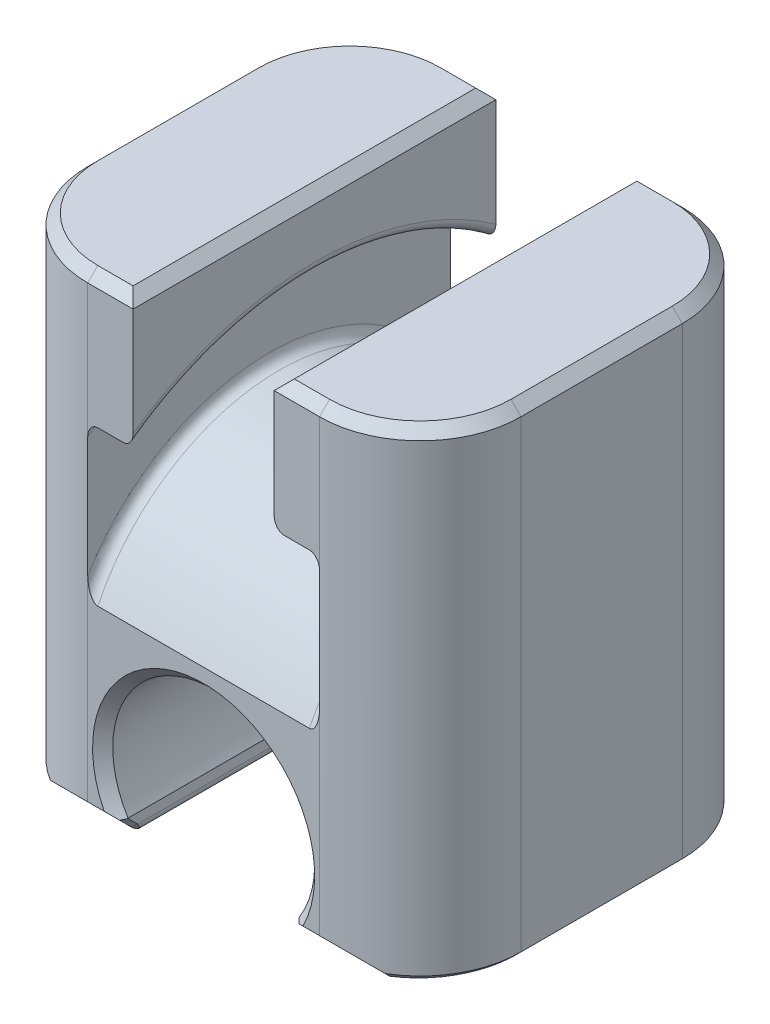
SolidWorks part; units mm, degrees
ref_plane "Front Plane" through (0, 0, 0) normal (0, 0, 1) x (1, 0, 0)
ref_plane "Top Plane" through (0, 0, 0) normal (0, 1, 0) x (1, 0, 0)
ref_plane "Right Plane" through (0, 0, 0) normal (1, 0, 0) x (0, 0, -1)
sketch "Sketch1" plane through (0, 0, 0) normal (1, 0, 0) x (0, 0, -1)
  line L0 (0, 0) -> (0, -5.5) construction
  line L1 (-9, -5.5) -> (9, -5.5)
  line L2 (-9, -5.5) -> (-9, 18.5)
  line L3 (-9, 18.5) -> (9, 18.5)
  line L4 (9, -5.5) -> (9, 18.5)
  dimension "D1" = 18
  dimension "D2" = 5.5
  dimension "D3" = 18.5
  dimension "D5" = 24
extrude "Extrude1" add sketch "Sketch1" along normal mid plane 21.5
sketch "Sketch2" plane through (0, 0, 0) normal (0, 0, 1) x (1, 0, 0)
  line L0 (0, -19.2503) -> (0, 19.2503) construction
  line L10 (0, 0) -> (-20.3314, 0) construction
  line L11 (3.5, 22.132) -> (3.5, 15.02)
  line L12 (3.5, 15.02) -> (5.75, 15.02)
  line L13 (5.75, 15.02) -> (5.75, 10)
  line L14 (5.75, 10) -> (-5.75, 10)
  line L15 (-5.75, 10) -> (-5.75, 15.02)
  line L16 (-5.75, 15.02) -> (-3.5, 15.02)
  line L17 (-3.5, 15.02) -> (-3.5, 22.132)
  line L18 (-3.5, 22.132) -> (3.5, 22.132)
  point P23 (4.625, 15.02)
  dimension "D5" = 7
  dimension "D8" = 11.5
  dimension "D9" = 10
  dimension "D10" = 15.02
  dimension "D11" = 7.112
revolve "Cut-Revolve1" cut sketch "Sketch2" angle 180 mid plane about L10
fillet "Fillet1" radius 5 4 edges at (10.75, 6.5, -9) (10.75, 6.5, 9) (-10.75, 6.5, 9) (-10.75, 6.5, -9)
fillet "Fillet3" radius 0.5 4 edges at (5.75, 10, 0) (5.75, 15.02, 0) (-5.75, 10, 0) (-5.75, 15.02, 0)
fillet "Fillet4" radius 0.5 2 edges at (-3.5, 15.02, 0) (3.5, 15.02, 0)
sketch "Sketch5" plane through (0, 0, 0) normal (0, 0, -1) x (-1, 0, 0)
  line L0 (4.25, -5.5) -> (-4.25, -5.5)
  line L1 (-5.75, -5.5) -> (5.75, -5.5) construction
  line L2 (-4.25, -5.5) -> (-4.25, -4.5004)
  line L4 (4.25, -4.5004) -> (4.25, -5.5)
  line L5 (0, -6.4116) -> (0, -1.8476) construction
  line L6 (0, 3.1624) -> (7.6462, 3.1624) construction
  line L7 (-5.75, -5.5) -> (5.75, -5.5) construction
  arc A0 (4.25, -4.5004) -> (-4.25, -4.5004) centre (0, -1.8476) ccw
  dimension "D1" = 10.02
  dimension "D2" = 1.8476
  dimension "D3" = 8.5
  dimension "D4" = 0.9144
  dimension "D5" = 3.6524
  dimension "D6" = 0.76
extrude "Cut-Extrude3" cut sketch "Sketch5" against normal through all both and the other way through all
sketch "Sketch7" plane through (0, 0, 0) normal (-1, 0, 0) x (0, 0, -1)
  line L0 (7.8, 5.5) -> (9, 4.3)
  line L1 (-4, 5.5) -> (-9, 5.5) construction
  line L2 (0, 0) -> (0, 6.4577) construction
  line L3 (0, 0) -> (6.8869, 0) construction
  line L4 (7.8, 5.5) -> (9, 5.5)
  line L5 (9, 5.5) -> (9, 4.3)
  line L6 (9, 5.5) -> (9, -5.4083) construction
  dimension "D1" = 45
  dimension "D2" = 1.2
extrude "Cut - remove" cut sketch "Sketch7" against normal through all both and the other way through all
mirror "Mirror2" about plane through (0, 0, 0) normal (0, 0, 1) of "Cut - remove"
fillet "Fillet5" radius 0.5 2 edges at (-4.25, -5.5, 0) (4.25, -5.5, 0)
chamfer "Chamfer2" distance 0.5 angle 45 2 edges at (0, 3.1624, -9) (0, 3.1624, 9)
chamfer "Chamfer3" distance 0.2 angle 45 12 edges at (4.25, -4.8473, -8.4527) (4.25, -4.8473, 8.4527) (-4.25, -4.8473, -8.4527) (-4.25, -4.8473, 8.4527) (6.8748, -5.5, -7.8) (4.3964, -5.3536, -7.9464) (6.8748, -5.5, 7.8) (4.3964, -5.3536, 7.9464) (-6.8748, -5.5, -7.8) (-4.3964, -5.3536, -7.9464) (-6.8748, -5.5, 7.8) (-4.3964, -5.3536, 7.9464)
chamfer "Chamfer4" distance 0.5 angle 45 6 edges at (10.75, -5.5, 0) (-10.75, -5.5, 0) (10.3173, -5.5, 6.0347) (10.3173, -5.5, -6.0347) (-10.3173, -5.5, 6.0347) (-10.3173, -5.5, -6.0347)
sketch "Sketch6" plane through (0, 0, 0) normal (0, 0, -1) x (-1, 0, 0)
  line L0 (-10.75, -5.196) -> (-4.95, -5.5)
  line L1 (-10.75, -5) -> (-10.75, 18.5) construction
  line L2 (-10.75, -5.196) -> (-10.75, -5.5)
  line L3 (-10.75, -5.5) -> (-4.95, -5.5)
  line L4 (-4.75, -5.5) -> (-8.2863, -5.5) construction
  dimension "D1" = 3
  dimension "D2" = 5.8
extrude "Cut-Extrude4" cut sketch "Sketch6" against normal through all both and the other way through all
mirror "Mirror1" about plane through (0, 0, 0) normal (1, 0, 0) of "Cut-Extrude4"
chamfer "Chamfer5" distance 0.5 angle 45 12 edges at (-9.2855, 18.5, -7.5355) (4.625, 18.5, -9) (-4.625, 18.5, -9) (3.5, 18.5, 0) (4.625, 18.5, 9) (-4.625, 18.5, 9) (-9.2855, 18.5, 7.5355) (9.2855, 18.5, 7.5355) (-3.5, 18.5, 0) (9.2855, 18.5, -7.5355) (-10.75, 18.5, 0) (10.75, 18.5, 0)
sketch "Sketch8" plane through (0, 0, 0) normal (1, 0, 0) x (0, 0, -1)
  line L1 (-5.5, 3.5624) -> (-5.5, 2.6624)
  line L2 (-5.5, 2.6624) -> (-6.2874, 2.6624)
  line L3 (-9, -4.3) -> (-9, 5.4083) construction
  line L4 (-6.2874, 2.6624) -> (-6.2874, 3.5624)
  line L6 (-6.2874, 3.5624) -> (-5.5, 3.5624)
  line L7 (8.5, 3.1624) -> (-8.5, 3.1624) construction
  line L8 (-5.5, 4.9716) -> (-5.5, 0.4549) construction
  line L9 (-6.2874, 3.1624) -> (-5.5, 2.1985) construction
  circle A0 centre (-5.5, 2.1985) radius 1.2446 construction
  point P15 (-5.5, 3.4431)
  dimension "D6" = 2.4892
  dimension "D1" = 90
  dimension "D2" = 0.5
  dimension "D3" = 1.5748
  dimension "D4" = 3.5
  dimension "D5" = 0.4
  dimension "D7" = 0.2807
  dimension "D8" = 0.4
revolve "Cut-Revolve2" cut sketch "Sketch8" angle 360 about L1
sketch "Sketch9" plane through (0, 0, 0) normal (1, 0, 0) x (0, 0, -1)
  line L3 (0, 12.3304) -> (0, 0) construction
  line L4 (0, 0) -> (-1.1409, 13.0407) construction
  line L5 (-0.8716, 9.9619) -> (-1.656, 9.8933)
  line L6 (-1.656, 9.8933) -> (-1.6124, 9.3952)
  line L7 (-1.6124, 9.3952) -> (-0.828, 9.4638)
  line L8 (-0.828, 9.4638) -> (-0.8716, 9.9619)
  arc A1 (9, 4.3589) -> (-9, 4.3589) centre (0, 0) ccw construction
  circle A2 centre (-0.9239, 10.5607) radius 0.9906 construction
  point P13 (-0.8376, 9.5739)
  dimension "D3" = 0.5
  dimension "D5" = 1.9812
  dimension "D1" = 5
  dimension "D2" = 1.5748
  dimension "D4" = 90
  dimension "D6" = 0.3895
revolve "Cut-Revolve3" cut sketch "Sketch9" angle 360 about L4
pattern_circular "CirPattern1" count 2 over 5 about axis through (0, 0, 0) along (1, 0, 0) of "Cut-Revolve3"
